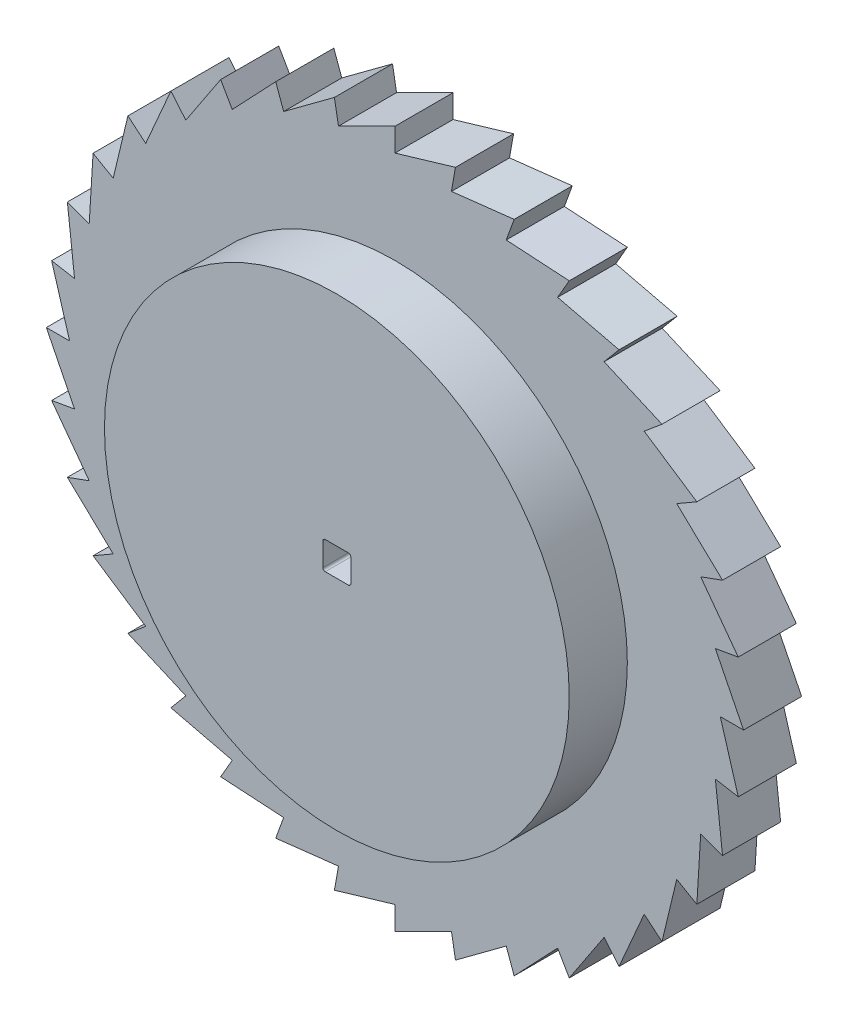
SolidWorks part; units mm, degrees
ref_plane "Front Plane" through (0, 0, 0) normal (0, 0, 1) x (1, 0, 0)
ref_plane "Top Plane" through (0, 0, 0) normal (0, 1, 0) x (1, 0, 0)
ref_plane "Right Plane" through (0, 0, 0) normal (1, 0, 0) x (0, 0, -1)
sketch "Sketch1" plane through (0, 0, 0) normal (0, 0, 1) x (1, 0, 0)
  line L0 (6.1749, 35.0198) -> (13.031, 35.8023)
  line L1 (6.1749, 35.0198) -> (6.616, 37.5212)
  line L2 (0, 35.56) -> (6.616, 37.5212)
  line L3 (12.1622, 33.4155) -> (13.031, 35.8023)
  line L4 (12.1622, 33.4155) -> (19.05, 32.9956)
  line L5 (17.78, 30.7959) -> (19.05, 32.9956)
  line L6 (17.78, 30.7959) -> (24.4902, 29.1863)
  line L7 (22.8575, 27.2405) -> (24.4902, 29.1863)
  line L8 (22.8575, 27.2405) -> (29.1863, 24.4902)
  line L9 (27.2405, 22.8575) -> (29.1863, 24.4902)
  line L10 (27.2405, 22.8575) -> (32.9956, 19.05)
  line L11 (30.7959, 17.78) -> (32.9956, 19.05)
  line L12 (30.7959, 17.78) -> (35.8023, 13.031)
  line L13 (33.4155, 12.1622) -> (35.8023, 13.031)
  line L14 (33.4155, 12.1622) -> (37.5212, 6.616)
  line L15 (35.0198, 6.1749) -> (37.5212, 6.616)
  line L16 (35.0198, 6.1749) -> (38.1, 0)
  line L17 (35.56, 0) -> (38.1, 0)
  line L18 (35.56, 0) -> (37.5212, -6.616)
  line L19 (35.0198, -6.1749) -> (37.5212, -6.616)
  line L20 (35.0198, -6.1749) -> (35.8023, -13.031)
  line L21 (33.4155, -12.1622) -> (35.8023, -13.031)
  line L22 (33.4155, -12.1622) -> (32.9956, -19.05)
  line L23 (30.7959, -17.78) -> (32.9956, -19.05)
  line L24 (30.7959, -17.78) -> (29.1863, -24.4902)
  line L25 (27.2405, -22.8575) -> (29.1863, -24.4902)
  line L26 (27.2405, -22.8575) -> (24.4902, -29.1863)
  line L27 (22.8575, -27.2405) -> (24.4902, -29.1863)
  line L28 (22.8575, -27.2405) -> (19.05, -32.9956)
  line L29 (17.78, -30.7959) -> (19.05, -32.9956)
  line L30 (17.78, -30.7959) -> (13.031, -35.8023)
  line L31 (12.1622, -33.4155) -> (13.031, -35.8023)
  line L32 (12.1622, -33.4155) -> (6.616, -37.5212)
  line L33 (6.1749, -35.0198) -> (6.616, -37.5212)
  line L34 (6.1749, -35.0198) -> (0, -38.1)
  line L35 (0, -35.56) -> (0, -38.1)
  line L36 (0, -35.56) -> (-6.616, -37.5212)
  line L37 (-6.1749, -35.0198) -> (-6.616, -37.5212)
  line L38 (-6.1749, -35.0198) -> (-13.031, -35.8023)
  line L39 (-12.1622, -33.4155) -> (-13.031, -35.8023)
  line L40 (-12.1622, -33.4155) -> (-19.05, -32.9956)
  line L41 (-17.78, -30.7959) -> (-19.05, -32.9956)
  line L42 (-17.78, -30.7959) -> (-24.4902, -29.1863)
  line L43 (-22.8575, -27.2405) -> (-24.4902, -29.1863)
  line L44 (-22.8575, -27.2405) -> (-29.1863, -24.4902)
  line L45 (-27.2405, -22.8575) -> (-29.1863, -24.4902)
  line L46 (-27.2405, -22.8575) -> (-32.9956, -19.05)
  line L47 (-30.7959, -17.78) -> (-32.9956, -19.05)
  line L48 (-30.7959, -17.78) -> (-35.8023, -13.031)
  line L49 (-33.4155, -12.1622) -> (-35.8023, -13.031)
  line L50 (-33.4155, -12.1622) -> (-37.5212, -6.616)
  line L51 (-35.0198, -6.1749) -> (-37.5212, -6.616)
  line L52 (-35.0198, -6.1749) -> (-38.1, 0)
  line L53 (-35.56, 0) -> (-38.1, 0)
  line L54 (-35.56, 0) -> (-37.5212, 6.616)
  line L55 (-35.0198, 6.1749) -> (-37.5212, 6.616)
  line L56 (-35.0198, 6.1749) -> (-35.8023, 13.031)
  line L57 (-33.4155, 12.1622) -> (-35.8023, 13.031)
  line L58 (-33.4155, 12.1622) -> (-32.9956, 19.05)
  line L59 (-30.7959, 17.78) -> (-32.9956, 19.05)
  line L60 (-30.7959, 17.78) -> (-29.1863, 24.4902)
  line L61 (-27.2405, 22.8575) -> (-29.1863, 24.4902)
  line L62 (-27.2405, 22.8575) -> (-24.4902, 29.1863)
  line L63 (-22.8575, 27.2405) -> (-24.4902, 29.1863)
  line L64 (-22.8575, 27.2405) -> (-19.05, 32.9956)
  line L65 (-17.78, 30.7959) -> (-19.05, 32.9956)
  line L66 (-17.78, 30.7959) -> (-13.031, 35.8023)
  line L67 (-12.1622, 33.4155) -> (-13.031, 35.8023)
  line L68 (-12.1622, 33.4155) -> (-6.616, 37.5212)
  line L69 (-6.1749, 35.0198) -> (-6.616, 37.5212)
  line L70 (-6.1749, 35.0198) -> (0, 38.1)
  line L71 (0, 35.56) -> (0, 38.1)
  point P113 (0, 0)
  dimension "D1" = 36
extrude "Boss-Extrude1" add sketch "Sketch1" along normal blind 6.35
sketch "Sketch2" plane through (0, 0, 6.35) normal (0, 0, 1) x (1, 0, 0)
  circle A0 centre (0, 0) radius 25.4
extrude "Boss-Extrude2" add sketch "Sketch2" along normal blind 6.35
sketch "Sketch3" plane through (0, 0, 0) normal (0, 0, -1) x (-1, 0, 0)
  line L1 (-1.524, 1.524) -> (1.524, 1.524)
  line L2 (-1.524, 1.524) -> (-1.524, -1.524)
  line L3 (-1.524, -1.524) -> (1.524, -1.524)
  line L4 (1.524, 1.524) -> (1.524, -1.524)
  line L5 (-1.524, 1.524) -> (1.524, -1.524) construction
  line L6 (-1.524, -1.524) -> (1.524, 1.524) construction
  point P0 (0, 0)
  dimension "D1" = 3.048
  dimension "D2" = 3.048
extrude "Cut-Extrude1" cut sketch "Sketch3" against normal through all
fillet "Fillet1" radius 0.254 4 edges at (1.524, -1.524, 6.35) (-1.524, -1.524, 6.35) (-1.524, 1.524, 6.35) (1.524, 1.524, 6.35)
